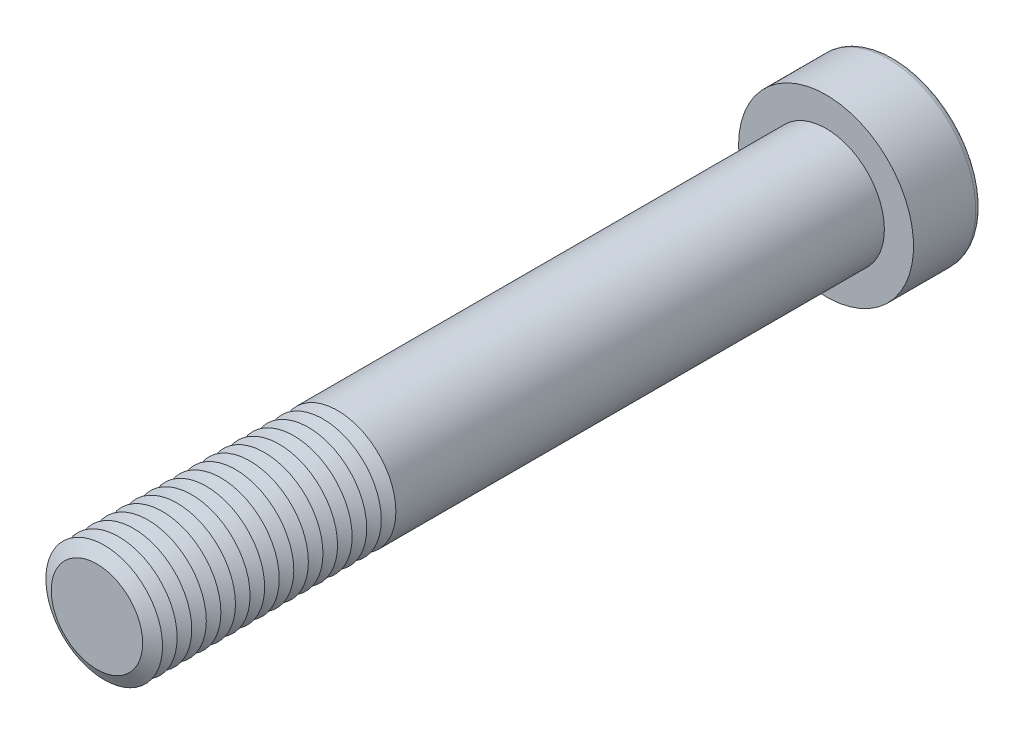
SolidWorks part; units mm, degrees
ref_plane "Front Plane" through (0, 0, 0) normal (0, 0, 1) x (1, 0, 0)
ref_plane "Top Plane" through (0, 0, 0) normal (0, 1, 0) x (1, 0, 0)
ref_plane "Right Plane" through (0, 0, 0) normal (1, 0, 0) x (0, 0, -1)
sketch "Sketch1" plane through (0, 0, 0) normal (0, 0, 1) x (1, 0, 0)
  circle A0 centre (0, 0) radius 12
  dimension "D1" = 24
extrude "Boss-Extrude1" add sketch "Sketch1" along normal blind 150
sketch "Sketch2" plane through (0, 0, 0) normal (0, 0, -1) x (-1, 0, 0)
  circle A0 centre (0, 0) radius 18
  dimension "D1" = 36
extrude "Boss-Extrude2" add sketch "Sketch2" along normal blind 14
sketch "Sketch3" plane through (0, 0, -14) normal (0, 0, -1) x (-1, 0, 0)
  line L1 (-5.4848, 9.5) -> (-10.9697, 0)
  line L2 (-10.9697, 0) -> (-5.4848, -9.5)
  line L3 (-5.4848, -9.5) -> (5.4848, -9.5)
  line L4 (5.4848, -9.5) -> (10.9697, 0)
  line L5 (10.9697, 0) -> (5.4848, 9.5)
  line L6 (5.4848, 9.5) -> (-5.4848, 9.5)
  circle A0 centre (0, 0) radius 9.5 construction
  dimension "D1" = 19
extrude "Cut-Extrude1" cut sketch "Sketch3" against normal blind 14.25
fillet "Fillet1" radius 1.2 1 edges at (-18, 0, -14)
sketch "Sketch4" plane through (0, 0, 0.25) normal (0, 0, -1) x (-1, 0, 0)
  line L0 (5.4848, -9.5) -> (10.9697, 0) construction
  circle A0 centre (0, 0) radius 9.5
extrude "Cut-Extrude2" cut sketch "Sketch4" against normal through all draft 60
sketch "Sketch5" plane through (0, 0, -14) normal (0, 0, -1) x (-1, 0, 0)
  circle A0 centre (0, 0) radius 10.9697
extrude "Cut-Extrude3" cut sketch "Sketch5" against normal through all draft 75
sketch "Sketch7" plane through (0, 0, 0) normal (1, 0, 0) x (0, 0, -1)
  line L25 (-150, 9.4019) -> (-148.5, 12)
  line L26 (-150, 12) -> (-150, -12) construction
  line L27 (-148.5, 12) -> (-151.5, 12)
  line L28 (-151.5, 12) -> (-150, 9.4019)
  line L29 (0, 12) -> (-150, 12) construction
  dimension "D1" = 3
revolve "Cut-Revolve1" cut sketch "Sketch7" angle 360 about axis through (0, 0, 150) along (0, 0, -1)
pattern_linear "LPattern1" count 17 spacing 3 along (0, 0, -1) of "Cut-Revolve1"
